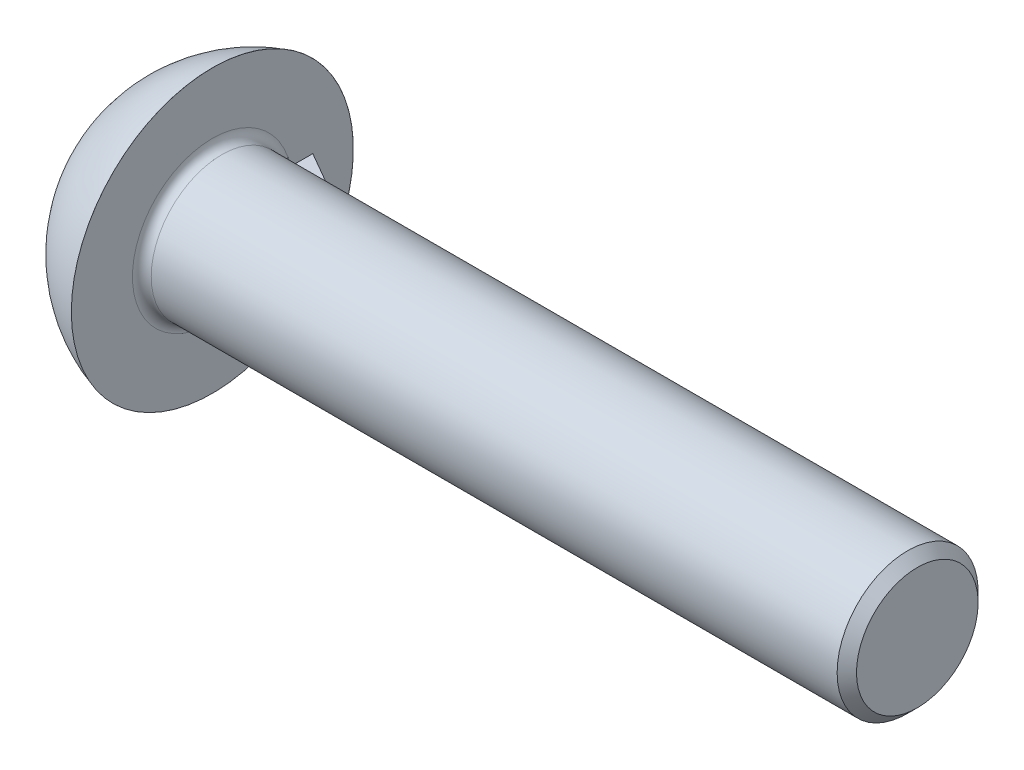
SolidWorks part; units mm, degrees
ref_plane "Front" through (0, 0, 0) normal (0, 0, 1) x (1, 0, 0)
ref_plane "Top" through (0, 0, 0) normal (0, 1, 0) x (1, 0, 0)
ref_plane "Right" through (0, 0, 0) normal (1, 0, 0) x (0, 0, -1)
sketch "Sketch1" plane through (0, 0, 0) normal (0, 0, 1) x (1, 0, 0)
  line L0 (-9.8282, 0) -> (16.3483, 0) construction
  line L1 (17.9999, 24) -> (18, 24)
  line L2 (0, 0) -> (18, 0)
  line L3 (18, 24) -> (18, 0)
  arc A0 (17.9999, 24) -> (0, 0) centre (25, 0) ccw
  dimension "Head_dia" = 48
  dimension "Head_thickness" = 18
  dimension "H" = 0.0001
revolve "BaseHead" add sketch "Sketch1" angle 360 about L0
sketch "BodySke" plane through (0, 0, 0) normal (0, 1, 0) x (1, 0, 0)
  line L0 (-12.2854, 0) -> (141.5775, 0) construction
  line L1 (136.352, 12) -> (18, 12)
  line L2 (84, 18.4981) -> (84, -12.5734) construction
  line L4 (18, -24) -> (18, 24) construction
  line L5 (138, 10.352) -> (138, 0)
  line L6 (138, 0) -> (18, 0)
  line L7 (18, 0) -> (18, 12)
  line L8 (135, 21.1398) -> (135, -17.9826) construction
  line L9 (136.352, 12) -> (138, 10.352)
  dimension "Diameter" = 24
  dimension "Length" = 120
  dimension "Ang" = 45
  dimension "Minor_dia" = 20.704
  dimension "Advance" = 3
  dimension "Thread_length" = 54
revolve "BaseBody" add sketch "BodySke" angle 360 about L0
fillet "Fillet" radius 1.6 1 edges at (18, 0, 12)
sketch "Sketch3" plane through (0, 0, 0) normal (0, 1, 0) x (1, 0, 0)
  line L0 (18, 17.1) -> (47.6181, 0)
  line L1 (18, 0) -> (18, 12) construction
  line L2 (138, 0) -> (18, 0) construction
  line L3 (136.352, 12) -> (18, 12) construction
  line L4 (18, 17.1) -> (18, 0)
  line L5 (18, 0) -> (47.6181, 0)
  dimension "D1" = 30
  dimension "Nib_height" = 5.1
extrude "Nib" add sketch "Sketch3" along normal mid plane 5.6
sketch "ThdSchSke" plane through (0, 0, 0) normal (0, 0, 1) x (1, 0, 0)
  line L0 (134.0485, 13.9029) -> (135.9515, 13.9029)
  line L1 (135.9515, 13.9029) -> (135.9515, 12)
  line L2 (135.9515, 12) -> (135, 10.352)
  line L3 (134.0485, 12) -> (135, 10.352)
  line L4 (134.0485, 13.9029) -> (134.0485, 12)
  line L5 (-65.6461, 0) -> (65.6461, 0) construction
  line L6 (134.0485, 12) -> (135.9515, 12) construction
  line L7 (135, 12) -> (135, 10.352) construction
  line L10 (138, -10.352) -> (138, 10.352) construction
  dimension "D1" = 20.704
  dimension "D3" = 3
  dimension "D4" = 24
revolve "ThreadSchematic" [suppressed] cut sketch "ThdSchSke" angle 360 about L5
pattern_linear "ThdSchPat" [suppressed] count 17 spacing 3 along (1, 0, 0)
equation "\"D3@ThdSchPat\" =\"Advance@BodySke\""
equation "\"D1@ThdSchPat\" =  int( \"Thread_length@BodySke\"/\"Advance@BodySke\") -1"
equation "\"D1@ThdSchSke\"=\"Minor_dia@BodySke\""
equation "\"D4@ThdSchSke\"=\"Diameter@BodySke\""
equation "\"D3@ThdSchSke\"=\"Advance@BodySke\""
equation "\"D1@ThreadCosmetic\"=\"Thread_length@BodySke\""
equation "\"dn@ThreadCosmetic\" = \"Minor_dia@BodySke\""
